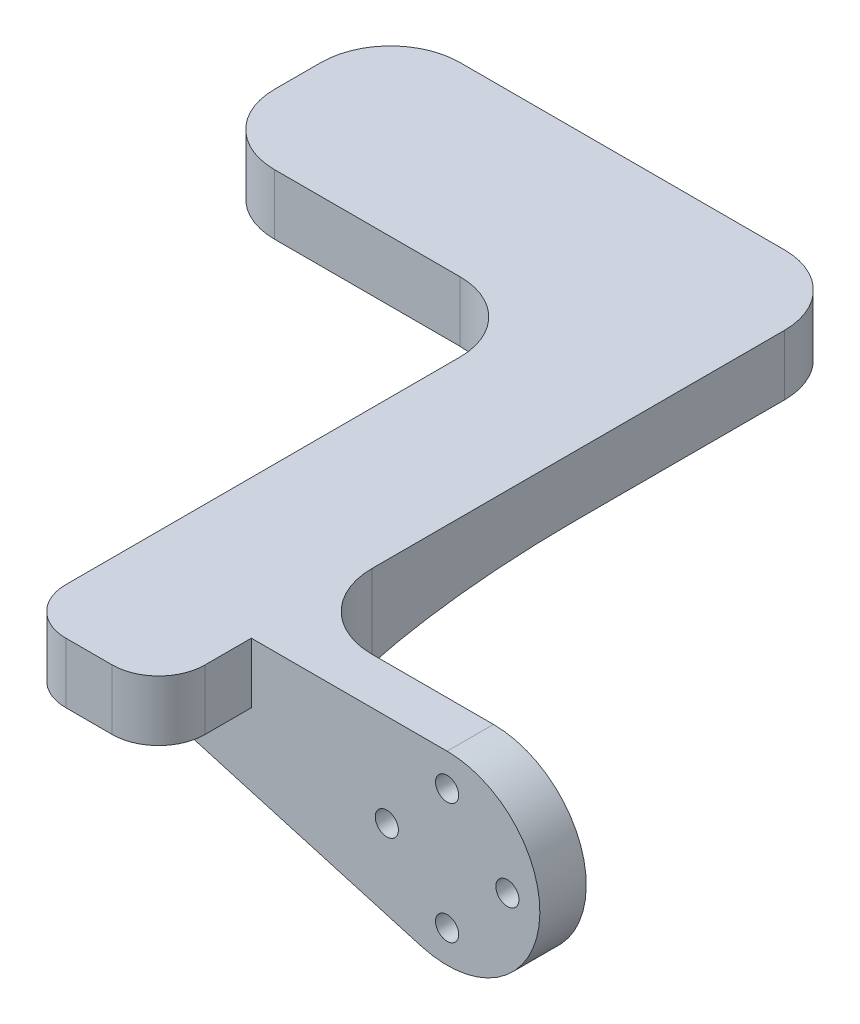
SolidWorks part; units mm, degrees
ref_plane "Front Plane" through (0, 0, 0) normal (0, 0, 1) x (1, 0, 0)
ref_plane "Top Plane" through (0, 0, 0) normal (0, 1, 0) x (1, 0, 0)
ref_plane "Right Plane" through (0, 0, 0) normal (1, 0, 0) x (0, 0, -1)
sketch "Sketch1" plane through (0, 0, 0) normal (0, 0, 1) x (1, 0, 0)
  circle A0 centre (0, 0) radius 10
  dimension "D1" = 20
extrude "Boss-Extrude1" add sketch "Sketch1" along normal blind 5
sketch "Sketch2" plane through (0, 0, 5) normal (0, 0, 1) x (1, 0, 0)
  circle A0 centre (0, 0) radius 6.5 construction
  circle A1 centre (0, 6.5) radius 1.25
  circle A2 centre (6.5, 0) radius 1.25
  circle A3 centre (0, -6.5) radius 1.25
  circle A4 centre (-6.5, 0) radius 1.25
  point P14 (0, 0)
  dimension "D1" = 13
  dimension "D2" = 2.5
  dimension "D3" = 4
extrude "Cut-Extrude1" cut sketch "Sketch2" against normal through all
sketch "Sketch3" plane through (0, 0, 0) normal (0, 0, -1) x (-1, 0, 0)
  circle A0 centre (0, 0) radius 2.5
  dimension "D1" = 5
extrude "Cut-Extrude2" cut sketch "Sketch3" against normal blind 2
ref_plane "Plane1" through (0, 10, 0) normal (0, 1, 0) x (1, 0, 0)
sketch "Sketch4" plane through (0, 10, 0) normal (0, 1, 0) x (1, 0, 0)
  line L0 (-21.11, -15) -> (-21.11, 60)
  line L1 (-21.11, 60) -> (-71.11, 60)
  line L2 (-71.11, 60) -> (-71.11, 40)
  line L3 (-71.11, 40) -> (-36.11, 40)
  line L4 (-36.11, 40) -> (-36.11, -15)
  line L5 (-36.11, -15) -> (-21.11, -15)
  line L6 (10, 0) -> (-10, 0) construction
  dimension "D1" = 15
  dimension "D2" = 15
  dimension "D3" = 20
  dimension "D4" = 75
  dimension "D5" = 21.11
  dimension "D6" = 50
extrude "Boss-Extrude2" add sketch "Sketch4" against normal blind 6.5 separate body
fillet "Fillet1" radius 5 2 edges at (-21.11, 6.75, 15) (-36.11, 6.75, 15)
fillet "Fillet2" radius 7.5 4 edges at (-71.11, 6.75, -60) (-21.11, 6.75, -60) (-36.11, 6.75, -40) (-71.11, 6.75, -40)
sketch "Sketch5" plane through (0, 0, 5) normal (0, 0, 1) x (1, 0, 0)
  line L0 (-36.11, 10) -> (-36.11, -0.0073)
  line L1 (-36.11, -0.0073) -> (-2.7674, -9.6095)
  line L2 (0, 10) -> (-36.11, 10)
  line L3 (2.75, 10) -> (-2.75, 10) construction
  circle A0 centre (0, 0) radius 10 construction
  arc A1 (0, 10) -> (-2.7674, -9.6095) centre (0, 0) ccw
extrude "Boss-Extrude3" add sketch "Sketch5" against normal up to surface (5 mm away)
fillet "Fillet3" radius 7.5 1 edges at (-28.61, 3.5, 0)
fillet "Fillet4" radius 3 1 edges
fillet "Fillet5" radius 8 1 edges
